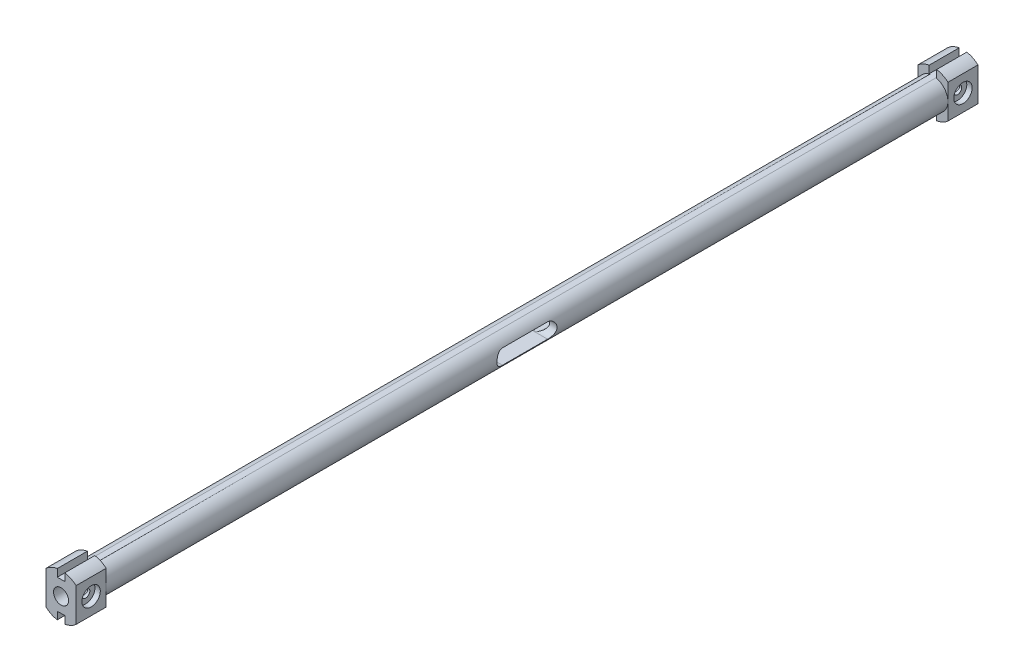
SolidWorks part; units mm, degrees
ref_plane "Front Plane" through (0, 0, 0) normal (0, 0, 1) x (1, 0, 0)
ref_plane "Top Plane" through (0, 0, 0) normal (0, 1, 0) x (1, 0, 0)
ref_plane "Right Plane" through (0, 0, 0) normal (1, 0, 0) x (0, 0, -1)
sketch "Sketch2" plane through (0, 0, 0) normal (1, 0, 0) x (0, 0, -1)
  line L0 (0, 0) -> (-300, 0) construction
  line L1 (0, 10) -> (-280, 10)
  line L2 (-300, 15) -> (-300, 0)
  line L3 (-280, 10) -> (-280, 15)
  line L4 (-300, 0) -> (0, 0)
  line L5 (-280, 15) -> (-300, 15)
  line L6 (0, 10) -> (0, 0)
  dimension "D1" = 300
  dimension "D2" = 15
  dimension "D3" = 10
  dimension "D4" = 20
revolve "Revolve1" add sketch "Sketch2" angle 360 about L0
sketch "Sketch3" plane through (0, 0, 300) normal (0, 0, 1) x (1, 0, 0)
  line L0 (10, 11.1803) -> (10, -11.1803)
  line L1 (0, 0) -> (0, -17.5204) construction
  line L2 (-10, 11.1803) -> (-10, -11.1803)
  circle A0 centre (0, 0) radius 15 construction
  arc A1 (10, -11.1803) -> (10, 11.1803) centre (0, 0) ccw
  arc A2 (-10, -11.1803) -> (-10, 11.1803) centre (0, 0) cw
  dimension "D1" = 10
extrude "Cut-Extrude1" cut sketch "Sketch3" against normal through all
hole_wizard "CBORE for M5 Hex Head Bolt1" positions "Sketch5" profile "Sketch4" counterbore size "M5" standard "Ansi Metric"
sketch "Sketch5" plane through (10, 0, 0) normal (1, 0, 0) x (0, 0, -1)
  line L0 (-290, 11.1803) -> (-290, -11.1803) construction
  line L1 (-280, 11.1803) -> (-300, 11.1803) construction
  line L2 (-280, -11.1803) -> (-300, -11.1803) construction
  point P0 (-290, 0)
sketch "Sketch4" plane through (10, 0, 290) normal (0, 1, 0) x (0, 0, -1)
  line L0 (0, 0) -> (0, 20)
  line L1 (0, 20) -> (2.75, 20)
  line L3 (2.75, 20) -> (2.75, 3.58)
  line L4 (2.75, 3.58) -> (6.12, 3.58)
  line L5 (6.12, 3.58) -> (6.12, 0)
  line L7 (6.12, 0) -> (0, 0)
  line L11 (0, -6.35) -> (0, 107.95) construction
  dimension "Thru Hole Dia." = 5.5
  dimension "Thru Hole Depth" = 20
  dimension "C'Bore Dia." = 12.24
  dimension "C'Bore Depth" = 3.58
mirror "Mirror1" about plane through (0, 10, 0) normal (0, 0, -1) of "Cut-Extrude1", "Revolve1", "CBORE for M5 Hex Head Bolt1"
sketch "Sketch6" plane through (0, 0, 0) normal (1, 0, 0) x (0, 0, -1)
  line L0 (0, 0) -> (19.943, 0) construction
  line L1 (-15, 5) -> (15, 5)
  line L2 (-15, -5) -> (15, -5)
  line L3 (0, 0) -> (0, 5) construction
  arc A0 (15, 5) -> (15, -5) centre (15, 0) cw
  arc A1 (-15, 5) -> (-15, -5) centre (-15, 0) ccw
  dimension "D1" = 10
  dimension "D2" = 30
extrude "Cut-Extrude2" cut sketch "Sketch6" against normal mid plane 30
sketch "Sketch7" plane through (0, 0, 300) normal (0, 0, 1) x (1, 0, 0)
  circle A0 centre (0, 0) radius 5
  dimension "D1" = 10
extrude "Cut-Extrude3" cut sketch "Sketch7" against normal through all
sketch "Sketch8" plane through (0, 0, 300) normal (0, 0, 1) x (1, 0, 0)
  line L0 (0, 0) -> (0, 15) construction
  line L1 (2.5, 14.7902) -> (2.5, 9.7902)
  line L2 (-2.5, 14.7902) -> (-2.5, 9.7902)
  line L3 (2.5, 9.7902) -> (-2.5, 9.7902)
  line L4 (-12.9965, 0) -> (12.9965, 0) construction
  line L5 (2.5, -9.7902) -> (-2.5, -9.7902)
  line L6 (-2.5, -14.7902) -> (-2.5, -9.7902)
  line L7 (2.5, -14.7902) -> (2.5, -9.7902)
  arc A0 (10, 11.1803) -> (-10, 11.1803) centre (0, 0) ccw construction
  arc A1 (2.5, 14.7902) -> (-2.5, 14.7902) centre (0, 0) ccw
  arc A2 (2.5, -14.7902) -> (-2.5, -14.7902) centre (0, 0) cw
  point P11 (0, 9.7902)
  point P15 (0, -9.7902)
  dimension "D1" = 5
  dimension "D2" = 5
extrude "Cut-Extrude4" cut sketch "Sketch8" against normal through all
